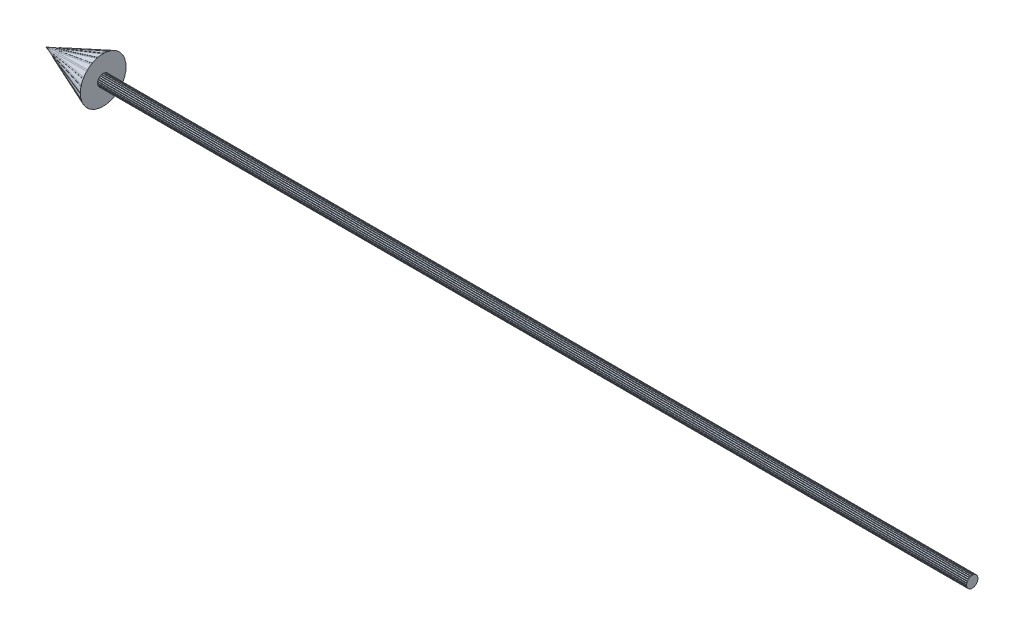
SolidWorks part; units mm, degrees
ref_plane "Face" through (0, 0, 0) normal (0, 0, 1) x (1, 0, 0)
ref_plane "Dessus" through (0, 0, 0) normal (0, 1, 0) x (1, 0, 0)
ref_plane "Droite" through (0, 0, 0) normal (1, 0, 0) x (0, 0, -1)
sketch "Esquisse1" plane through (0, 0, 0) normal (1, 0, 0) x (0, 0, -1)
  circle A0 centre (0, 0) radius 0.5
  dimension "D1" = 1
extrude "Boss.-Extru.1" add sketch "Esquisse1" along normal blind 75.96
sketch "Esquisse2" plane through (0, 0, 0) normal (0, 0, 1) x (1, 0, 0)
  line L0 (0, 0) -> (-11.2925, 0) construction
  line L1 (0, 0) -> (0, 2)
  line L2 (0, 2) -> (-5, 0)
  line L3 (-5, 0) -> (0, 0)
  dimension "D1" = 5
  dimension "D2" = 4
revolve "Révolution1" add sketch "Esquisse2" angle 360 about L0
sketch "Esquisse3" plane through (75.96, 0, 0) normal (1, 0, 0) x (0, 0, -1)
  line L0 (0, 0.48) -> (-0.05, 0.53)
  line L1 (-0.05, 0.53) -> (0.05, 0.53)
  line L2 (0.05, 0.53) -> (0, 0.48)
  line L3 (0, 0) -> (0, 0.48) construction
  dimension "D1" = 0.1
  dimension "D2" = 0.48
  dimension "D3" = 90
extrude "Enlèv. mat.-Extru.1" cut sketch "Esquisse3" against normal up to surface (75.96 mm away)
pattern_circular "Répétition circulaire1" count 24 over 360 about axis through (0, 0, 0) along (1, 0, 0) of "Enlèv. mat.-Extru.1"
sketch "Esquisse4" plane through (0, 0, 0) normal (0, 0, 1) x (1, 0, 0)
  line L0 (0, 1.9785) -> (-4.7721, 0.0696)
  line L1 (-4.7721, 0.0696) -> (-4.826, 0.0696)
  line L2 (0, 2) -> (-5, 0) construction
  line L3 (-4.826, 0.0696) -> (0, 2)
  line L4 (0, 2) -> (0, 1.9785)
  line L8 (0, 0.0196) -> (-6.1417, 0.0196) construction
  dimension "D1" = 0.02
  dimension "D2" = 0.05
extrude "Enlèv. mat.-Extru.2" cut sketch "Esquisse4" against normal mid plane 0.1
pattern_circular "Répétition circulaire2" count 24 over 360 about axis through (0, 0, 0) along (1, 0, 0) of "Enlèv. mat.-Extru.2"
